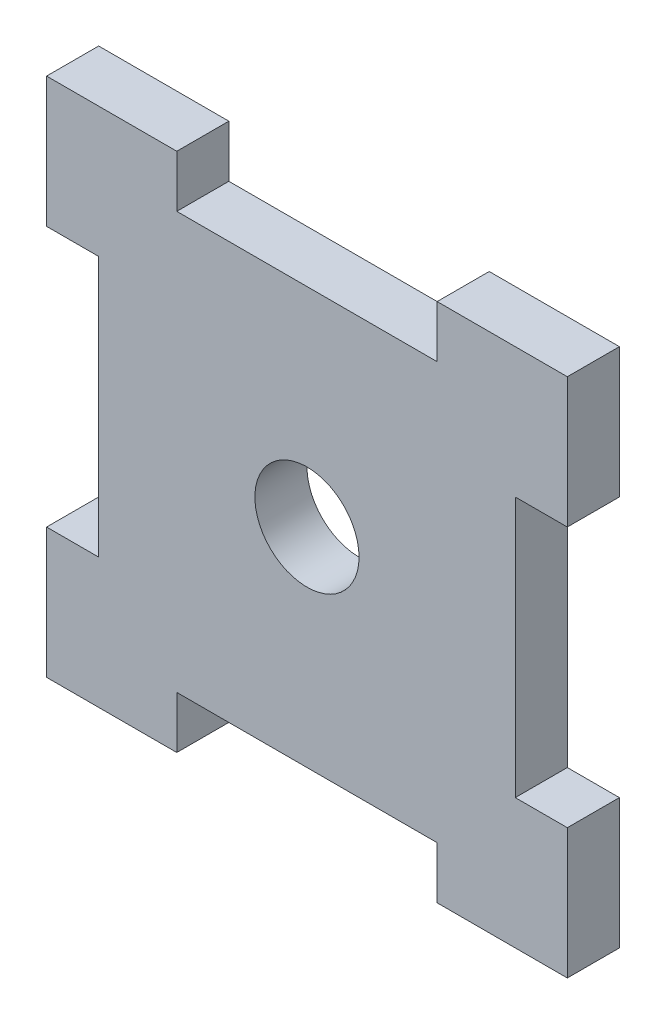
SolidWorks part; units mm, degrees
ref_plane "Alzado" through (0, 0, 0) normal (0, 0, 1) x (1, 0, 0)
ref_plane "Planta" through (0, 0, 0) normal (0, 1, 0) x (1, 0, 0)
ref_plane "Vista lateral" through (0, 0, 0) normal (1, 0, 0) x (0, 0, -1)
sketch "Croquis1" plane through (0, 0, 0) normal (0, 0, 1) x (1, 0, 0)
  line L0 (22.5, 0) -> (30, 0)
  line L9 (0, 0) -> (7.5, 0)
  line L10 (0, 0) -> (0, 7.5)
  line L15 (0, 30) -> (7.5, 30)
  line L16 (30, 0) -> (30, 7.5)
  line L17 (7.5, 27) -> (22.5, 27)
  line L18 (0, 22.5) -> (0, 30)
  line L19 (27, 22.5) -> (27, 7.5)
  line L20 (22.5, 30) -> (30, 30)
  line L21 (30, 22.5) -> (30, 30)
  line L22 (22.5, 27) -> (22.5, 30)
  line L23 (27, 22.5) -> (30, 22.5)
  line L24 (3, 22.5) -> (3, 7.5)
  line L25 (3, 22.5) -> (0, 22.5)
  line L26 (7.5, 27) -> (7.5, 30)
  line L27 (27, 7.5) -> (30, 7.5)
  line L28 (3, 7.5) -> (0, 7.5)
  line L29 (22.5, 3) -> (22.5, 0)
  line L30 (7.5, 3) -> (7.5, 0)
  line L31 (7.5, 3) -> (22.5, 3)
  circle A8 centre (15, 15) radius 3
  point P10 (15, 27)
  point P16 (27, 15)
  point P17 (19.5, 3.8)
  point P18 (10.5, 3.8)
  point P19 (15, 3.8)
  point P28 (22.5, 1.5)
  point P39 (10.5, 4.8)
  point P42 (11.5, 3.8)
  point P45 (18.5, 3.8)
  point P48 (19.5, 4.8)
extrude "Saliente-Extruir1" add sketch "Croquis1" along normal blind 3
